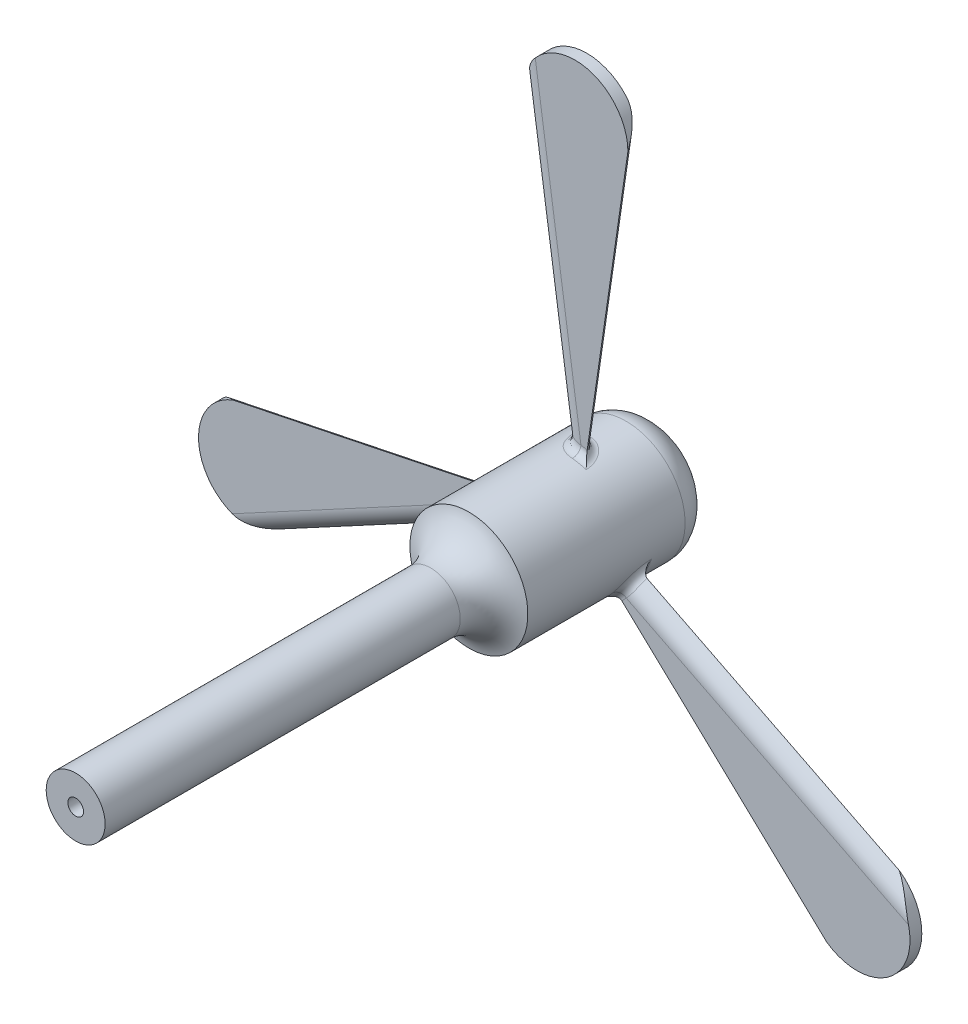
SolidWorks part; units mm, degrees
ref_plane "Front Plane" through (0, 0, 0) normal (0, 0, 1) x (1, 0, 0)
ref_plane "Top Plane" through (0, 0, 0) normal (0, 1, 0) x (1, 0, 0)
ref_plane "Right Plane" through (0, 0, 0) normal (1, 0, 0) x (0, 0, -1)
sketch "Sketch1" plane through (0, 0, 0) normal (0, 0, 1) x (1, 0, 0)
  circle A0 centre (0, 0) radius 7.5
  dimension "D1" = 15
extrude "Boss-Extrude1" add sketch "Sketch1" along normal blind 100
sketch "Sketch2" plane through (0, 0, 0) normal (0, 0, -1) x (-1, 0, 0)
  circle A0 centre (0, 0) radius 15
  dimension "D1" = 30
extrude "Boss-Extrude2" add sketch "Sketch2" along normal blind 40
fillet "Fillet1" radius 10 1 edges at (-7.5, 0, 0)
ref_plane "Plane1" through (0, 0, -30) normal (0, 0, -1) x (-1, 0, 0)
sketch "Sketch3" plane through (0, 0, -30) normal (0, 0, -1) x (-1, 0, 0)
  line L1 (13.448, 87.5929) -> (2.8056, 14.7353)
  line L2 (-13.448, 87.5929) -> (-2.8056, 14.7353)
  circle A0 centre (0, 0) radius 15 construction
  arc A1 (13.448, 87.5929) -> (-13.448, 87.5929) centre (0, 87.5929) ccw
  arc A2 (2.8056, 14.7353) -> (-2.8056, 14.7353) centre (0, -7.9484) ccw
extrude "Boss-Extrude3" add sketch "Sketch3" against normal blind 3
fillet "Fillet2" radius 5 2 edges at (8.1268, 51.1641, -30) (-8.1268, 51.1641, -27)
pattern_circular "CirPattern1" count 3 every 125 about axis through (0, 0, 0) along (0, 0, 1) of "Boss-Extrude3"
fillet "Fillet3" radius 5 2 edges at (46.5725, -22.6894, -27) (37.2498, -36.0036, -30)
fillet "Fillet4" radius 5 2 edges at (-50.858, -9.8624, -30) (-45.299, -25.1358, -27)
dome "Dome1" faces to dome 4 distance 10 parameters "D1"=10
fillet "Fillet5" radius 2 12 edges at (-2.3055, 14.8218, -30) (2.3055, 14.8218, -27) (13.4637, -6.6128, -30) (10.8189, -10.39, -27) (-14.7164, -2.9029, -27) (-13.1394, -7.2358, -30) (1.2592, 14.9471, -28.9836) (-1.2592, 14.9471, -28.0164) (11.5217, -9.6048, -28.9836) (12.9662, -7.5418, -28.0164) (-13.615, -6.2955, -28.0164) (-14.4763, -3.9289, -28.9836)
sketch "Sketch8" plane through (0, 0, 100) normal (0, 0, 1) x (1, 0, 0)
  circle A0 centre (0, 0) radius 1.9968
extrude "Cut-Extrude1" cut sketch "Sketch8" against normal blind 123
fillet "Fillet6" [suppressed] radius 2
